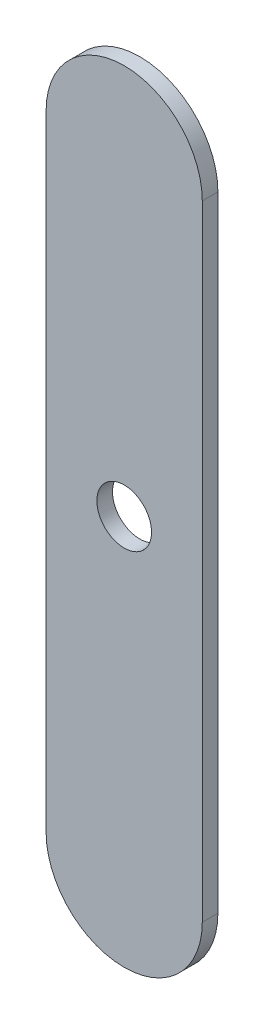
SolidWorks part; units mm, degrees
ref_plane "Front" through (0, 0, 0) normal (0, 0, 1) x (1, 0, 0)
ref_plane "Top" through (0, 0, 0) normal (0, 1, 0) x (1, 0, 0)
ref_plane "Right" through (0, 0, 0) normal (1, 0, 0) x (0, 0, -1)
sketch "Sketch1" plane through (0, 0, 0) normal (0, 0, 1) x (1, 0, 0)
  line L1 (5, 40) -> (5, 0)
  line L2 (-5, 40) -> (-5, 0)
  arc A0 (5, 40) -> (-5, 40) centre (0, 40) ccw
  arc A1 (-5, 0) -> (5, 0) centre (0, 0) ccw
  circle A2 centre (0, 20) radius 1.75
extrude "Extrude1" add sketch "Sketch1" along normal blind 1
